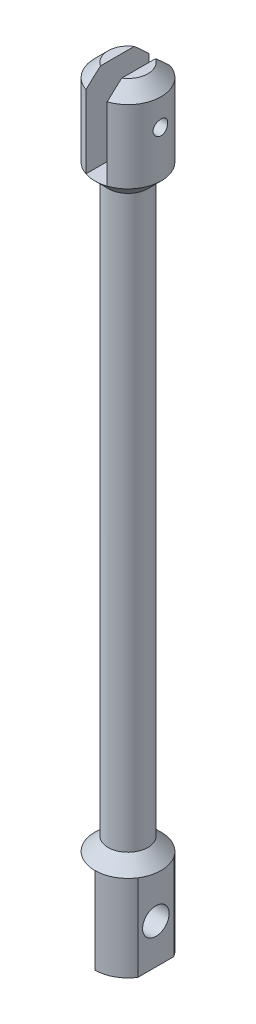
SolidWorks part; units mm, degrees
ref_plane "Front Plane" through (0, 0, 0) normal (0, 0, 1) x (1, 0, 0)
ref_plane "Top Plane" through (0, 0, 0) normal (0, 1, 0) x (1, 0, 0)
ref_plane "Right Plane" through (0, 0, 0) normal (1, 0, 0) x (0, 0, -1)
imported_body "Imported3"
sketch "Sketch1" plane through (0, 6.5, 0) normal (0, -1, 0) x (1, 0, 0)
  line L0 (2.1, 1.3565) -> (2.1, -1.3565)
  line L1 (0, -2.5) -> (0, 2.5)
  arc A0 (2.1, -1.3565) -> (0, -2.5) centre (0, 0) cw
  arc A1 (0, 2.5) -> (2.1, 1.3565) centre (0, 0) cw
extrude "Boss-Extrude1" add sketch "Sketch1" along normal blind 6.5
hole_wizard "Ø2.0 (2) Diameter Hole1" positions "Sketch3" profile "Sketch2" hole size "Ø2.0" standard "ANSI Metric"
sketch "Sketch3" plane through (0, 0, 0) normal (-1, 0, 0) x (0, 0, 1)
  point P0 (0, 3)
sketch "Sketch2" plane through (0, 3, 0) normal (0, 1, 0) x (0, 0, 1)
  line L0 (0, 0) -> (0, 2.5)
  line L1 (0, 2.5) -> (1, 2.5)
  line L2 (1, 2.5) -> (1, 0)
  line L5 (1, 0) -> (0, 0)
  line L11 (0, -6.35) -> (0, 107.95) construction
  dimension "Thru Hole Dia." = 2
  dimension "Thru Hole Depth" = 2.5
hole_wizard "Ø1.1 (1.1) Diameter Hole1" positions "Sketch5" profile "Sketch4" hole size "Ø1.1" standard "ANSI Metric"
sketch "Sketch5" plane through (0.8, 0, 0) normal (-1, 0, 0) x (0, 0, 1)
  point P0 (0, 55)
sketch "Sketch4" plane through (0.8, 55, 0) normal (0, 1, 0) x (0, 0, 1)
  line L0 (0, 0) -> (0, 1.7)
  line L1 (0, 1.7) -> (0.55, 1.7)
  line L2 (0.55, 1.7) -> (0.55, 0)
  line L5 (0.55, 0) -> (0, 0)
  line L11 (0, -6.35) -> (0, 107.95) construction
  dimension "Thru Hole Dia." = 1.1
  dimension "Thru Hole Depth" = 1.7
hole_wizard "Ø1.1 (1.1) Diameter Hole2" positions "Sketch7" profile "Sketch6" hole size "Ø1.1" standard "ANSI Metric"
sketch "Sketch7" plane through (-0.8, 0, 0) normal (1, 0, 0) x (0, 0, -1)
  point P0 (0, 55)
sketch "Sketch6" plane through (-0.8, 55, 0) normal (0, 1, 0) x (0, 0, -1)
  line L0 (0, 0) -> (0, 1.7)
  line L1 (0, 1.7) -> (0.55, 1.7)
  line L2 (0.55, 1.7) -> (0.55, 0)
  line L5 (0.55, 0) -> (0, 0)
  line L11 (0, -6.35) -> (0, 107.95) construction
  dimension "Thru Hole Dia." = 1.1
  dimension "Thru Hole Depth" = 1.7
